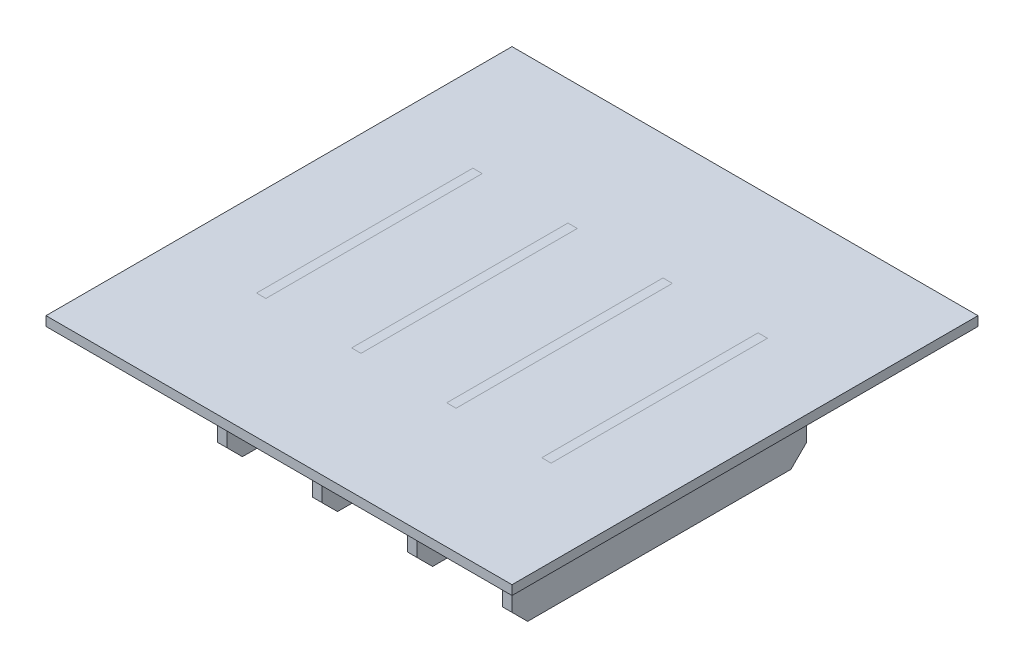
SolidWorks part; units mm, degrees
other "Exploded View1" [suppressed]
other "Explode Step1" [suppressed]
other "Explode Line1"
ref_plane "Front Plane" through (0, 0, 0) normal (0, 0, 1) x (1, 0, 0)
ref_plane "Top Plane" through (0, 0, 0) normal (0, 1, 0) x (1, 0, 0)
ref_plane "Right Plane" through (0, 0, 0) normal (1, 0, 0) x (0, 0, -1)
sketch "Sketch1" plane through (0, 0, 0) normal (0, 1, 0) x (1, 0, 0)
  line L1 (-297.5, 297.5) -> (297.5, 297.5)
  line L2 (-297.5, 297.5) -> (-297.5, -297.5)
  line L3 (-297.5, -297.5) -> (297.5, -297.5)
  line L4 (297.5, 297.5) -> (297.5, -297.5)
  line L5 (-297.5, 297.5) -> (297.5, -297.5) construction
  line L6 (-297.5, -297.5) -> (297.5, 297.5) construction
  point P0 (0, 0)
  dimension "D1" = 595
extrude "Boss-Extrude1" add sketch "Sketch1" along normal blind 12
sketch "Sketch2" plane through (0, 0, 0) normal (0, -1, 0) x (1, 0, 0)
  line L0 (-297.5, 0) -> (-188.1, 0) construction
  line L1 (-297.5, -297.5) -> (-297.5, 297.5) construction
  line L2 (-188.1, 0) -> (-176.1, 0) construction
  line L3 (-176.1, 0) -> (-66.7, 0) construction
  line L4 (-66.7, 0) -> (-54.7, 0) construction
  line L5 (-54.7, 0) -> (54.7, 0) construction
  line L6 (54.7, 0) -> (66.7, 0) construction
  line L7 (66.7, 0) -> (176.1, 0) construction
  line L8 (176.1, 0) -> (188.1, 0) construction
  line L9 (188.1, 0) -> (297.5, 0) construction
  line L10 (297.5, 297.5) -> (297.5, -297.5) construction
  dimension "D1" = 12
sketch "Sketch3" plane through (0, 0, 0) normal (0, -1, 0) x (1, 0, 0)
  line L0 (-188.1, 0) -> (-176.1, 0) construction
  line L1 (-176.1, -188.1) -> (-188.1, -188.1)
  line L2 (-176.1, -188.1) -> (-176.1, 188.1)
  line L3 (-176.1, 188.1) -> (-188.1, 188.1)
  line L4 (-188.1, -188.1) -> (-188.1, 188.1)
  line L5 (-176.1, -188.1) -> (-188.1, 188.1) construction
  line L6 (-176.1, 188.1) -> (-188.1, -188.1) construction
  line L7 (-297.5, 297.5) -> (297.5, 297.5) construction
  point P0 (-182.1, 0)
  dimension "D1" = 109.4
extrude "Boss-Extrude2" add sketch "Sketch3" along normal blind 148 separate body
chamfer "Chamfer1" distance 20 angle 45 2 edges at (-182.1, -148, -188.1) (-182.1, -148, 188.1)
sketch "Sketch4" plane through (0, 0, 0) normal (0, 1, 0) x (1, 0, 0)
  line L0 (-188.1, 0) -> (-176.1, 0) construction
  line L1 (-188.1, -138.1) -> (-176.1, -138.1)
  line L2 (-188.1, -138.1) -> (-188.1, 138.1)
  line L3 (-188.1, 138.1) -> (-176.1, 138.1)
  line L4 (-176.1, -138.1) -> (-176.1, 138.1)
  line L5 (-188.1, -138.1) -> (-176.1, 138.1) construction
  line L6 (-188.1, 138.1) -> (-176.1, -138.1) construction
  line L7 (-176.1, 188.1) -> (-176.1, -188.1) construction
  line L8 (-188.1, 188.1) -> (-176.1, 188.1) construction
  point P0 (-182.1, 0)
  dimension "D1" = 50
extrude "Boss-Extrude3" add sketch "Sketch4" along normal blind 12
sketch "Sketch5" plane through (0, 12, 0) normal (0, 1, 0) x (1, 0, 0)
  line L0 (-176.1, 138.1) -> (-188.1, 138.1) construction
  line L1 (-176.1, -138.1) -> (-176.1, 138.1) construction
  line L2 (-188.1, -138.1) -> (-176.1, -138.1) construction
  line L3 (-188.1, 138.1) -> (-188.1, -138.1) construction
  line L4 (-176.1, 138.1) -> (-188.1, 138.1)
  line L5 (-176.1, -138.1) -> (-176.1, 138.1)
  line L6 (-188.1, -138.1) -> (-176.1, -138.1)
  line L7 (-188.1, 138.1) -> (-188.1, -138.1)
extrude "Cut-Extrude1" cut sketch "Sketch5" against normal through all
pattern_linear "LPattern1" count 4 spacing 121.4 along (1, 0, 0)
pattern_linear "LPattern2" count 4 spacing 121.4 along (1, 0, 0) of "Cut-Extrude1"
move or copy body "Body-Move/Copy1" [suppressed] bodies to move or copy 108 copy no translate (0, 130.4055, 0) parameters "D1"=0, "D2"=0, "D3"=0
